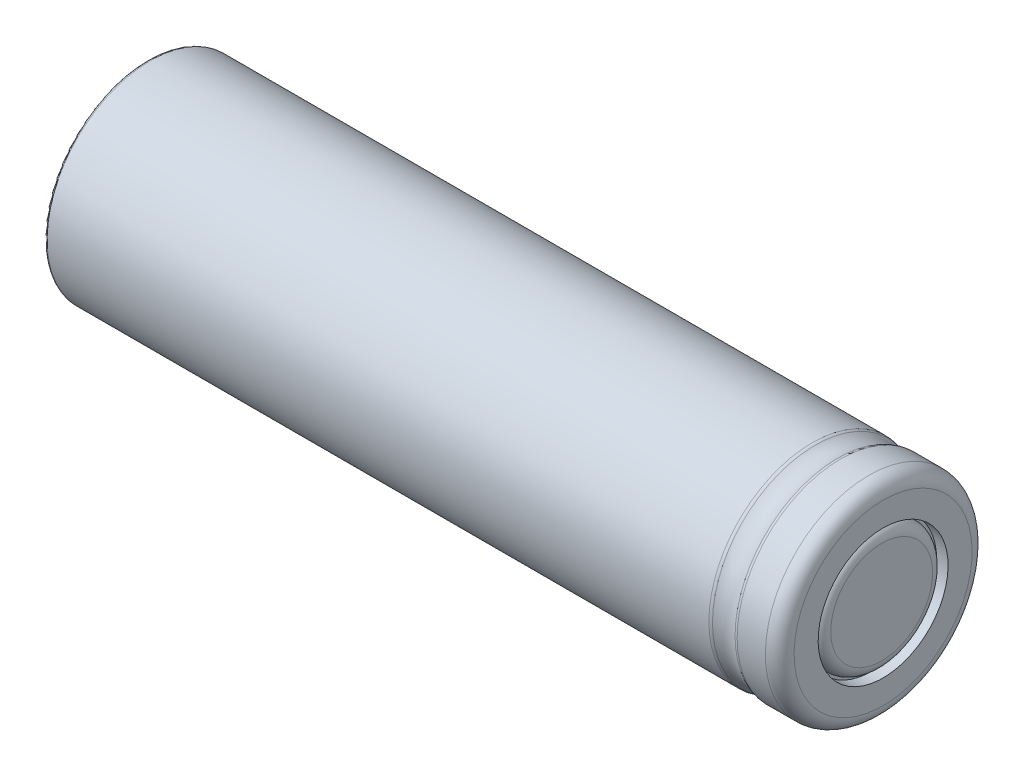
SolidWorks part; units mm, degrees
ref_plane "Front" through (0, 0, 0) normal (0, 0, 1) x (1, 0, 0)
ref_plane "Top" through (0, 0, 0) normal (0, 1, 0) x (1, 0, 0)
ref_plane "Right" through (0, 0, 0) normal (1, 0, 0) x (0, 0, -1)
sketch "Sketch1" plane through (0, 0, 0) normal (0, 0, 1) x (1, 0, 0)
  line L0 (0, 0) -> (0, 8.896)
  line L1 (0.254, 9.15) -> (63.83, 9.15)
  line L2 (65.1, 7.88) -> (65.1, 0)
  line L3 (65.1, 0) -> (0, 0)
  arc A0 (0.254, 9.15) -> (0, 8.896) centre (0.254, 8.896) ccw
  arc A1 (65.1, 7.88) -> (63.83, 9.15) centre (63.83, 7.88) ccw
  dimension "D1" = 0.254
  dimension "D4" = 1.27
  dimension "D2" = 65.1
  dimension "D3" = 9.15
revolve "base" add sketch "Sketch1" angle 360 about L3
sketch "Sketch2" plane through (0, 0, 0) normal (0, 0, 1) x (1, 0, 0)
  line L0 (63.83, 9.15) -> (61.33, 9.15)
  line L2 (0, 0) -> (64.5761, 0) construction
  line L3 (61.33, 9.15) -> (58.83, 9.15)
  line L4 (58.83, 9.15) -> (0, 9.15)
  arc A0 (61.08, 9.083) -> (59.08, 9.083) centre (60.08, 10.8151) cw
  arc A1 (59.08, 9.083) -> (58.83, 9.15) centre (58.83, 8.65) ccw
  arc A2 (61.33, 9.15) -> (61.08, 9.083) centre (61.33, 8.65) ccw
  point P0 (63.83, 9.15)
  dimension "D1" = 0.5
  dimension "D3" = 2
  dimension "D2" = 2.5
  dimension "D4" = 2.5
revolve "+ notch" cut sketch "Sketch2" angle 360 about L2
sketch "Sketch3" plane through (65.1, 0, 0) normal (1, 0, 0) x (0, 0, -1)
  circle A0 centre (0, 0) radius 5.75
  dimension "D1" = 11.5
extrude "Extrude1" cut sketch "Sketch3" against normal blind 1.016
sketch "Sketch4" plane through (64.084, 0, 0) normal (1, 0, 0) x (0, 0, -1)
  circle A0 centre (0, 0) radius 5.5
  dimension "D1" = 11
extrude "Extrude3" add sketch "Sketch4" along normal offset from surface (0.889 mm away) 0.127
sketch "Sketch5" plane through (0, 0, 0) normal (-1, 0, 0) x (0, 0, 1)
  circle A0 centre (0, 0) radius 7.5
  dimension "D1" = 15
extrude "Extrude4" cut sketch "Sketch5" against normal blind 0.0254
fillet "Fillet1" radius 1 1 edges at (64.973, 5.5, 0)
ref_plane "Plane1" through (0, 9.15, 0) normal (0, 1, 0) x (1, 0, 0)
